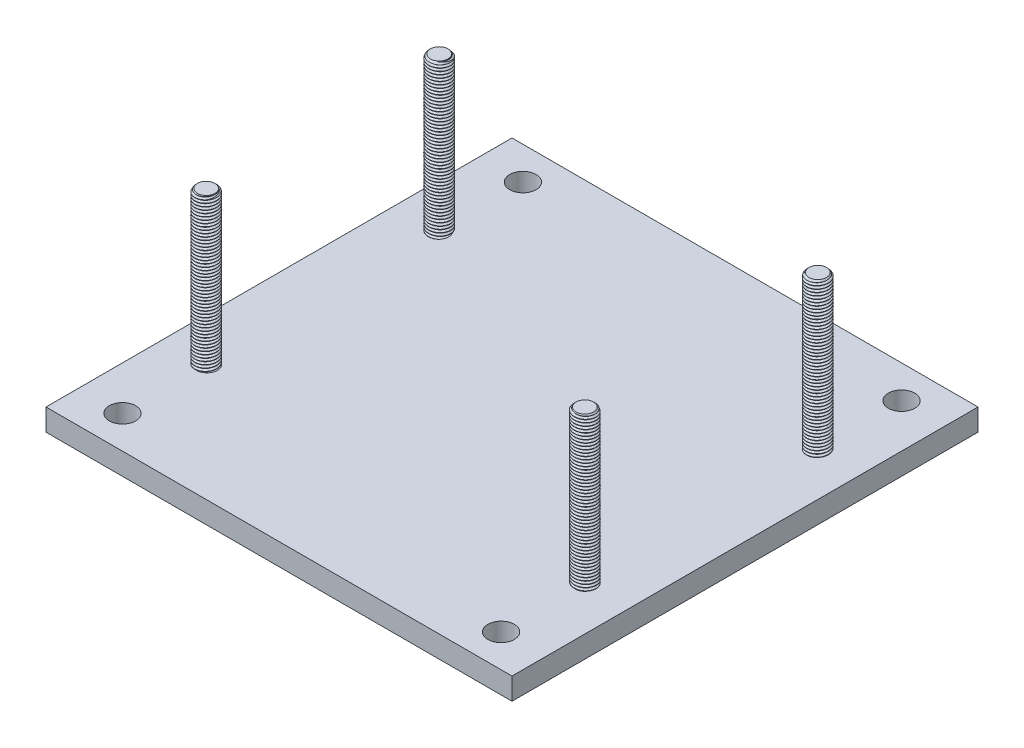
SolidWorks part; units mm, degrees
other "<95412A859_18-8 Stainless Steel Threaded Rod>-<Cut-Sweep1>"
ref_plane "Front Plane" through (0, 0, 0) normal (0, 0, 1) x (1, 0, 0)
ref_plane "Top Plane" through (0, 0, 0) normal (0, 1, 0) x (1, 0, 0)
ref_plane "Right Plane" through (0, 0, 0) normal (1, 0, 0) x (0, 0, -1)
sketch "Sketch1" plane through (0, 0, 0) normal (0, 1, 0) x (1, 0, 0)
  line L1 (-203.2, 203.2) -> (203.2, 203.2)
  line L2 (-203.2, 203.2) -> (-203.2, -203.2)
  line L3 (-203.2, -203.2) -> (203.2, -203.2)
  line L4 (203.2, 203.2) -> (203.2, -203.2)
  line L5 (-203.2, 203.2) -> (203.2, -203.2) construction
  line L6 (-203.2, -203.2) -> (203.2, 203.2) construction
  point P0 (0, 0)
  dimension "D1" = 406.4
extrude "Boss-Extrude1" add sketch "Sketch1" along normal blind 19.05
hole_wizard "3/4-10 Tapped Hole1" positions "Sketch2" profile "Sketch3" tap size "3/4-10" standard "ANSI Inch"
sketch "Sketch2" plane through (0, 19.05, 0) normal (0, 1, 0) x (1, 0, 0)
  point P0 (-165.1, -101.6)
  point P3 (165.1, -101.6)
  point P6 (-165.1, 101.6)
  point P9 (165.1, 101.6)
sketch "Sketch3" plane through (-165.1, 19.05, 101.6) normal (1, 0, 0) x (0, 0, 1)
  line L0 (0, 0) -> (0, 19.05)
  line L1 (0, 19.05) -> (8.3337, 19.05)
  line L2 (8.3337, 19.05) -> (8.3337, 0)
  line L5 (8.3337, 0) -> (0, 0)
  line L11 (0, -6.35) -> (0, 107.95) construction
  dimension "Thread Major Dia." = 16.6675
  dimension "Thru Tap Drill Depth" = 19.05
hole_wizard "7/8 Clearance Hole1" positions "Sketch4" profile "Sketch5" hole size "7/8" standard "ANSI Inch"
sketch "Sketch4" plane through (0, 19.05, 0) normal (0, 1, 0) x (1, 0, 0)
  line L0 (-203.2, 0) -> (-95.2664, 0) construction
  line L1 (-203.2, 203.2) -> (-203.2, -203.2) construction
  line L4 (-165.1, -101.6) -> (-165.1, -174.625) construction
  line L6 (-203.2, -203.2) -> (203.2, -203.2) construction
  line L7 (0, -203.2) -> (0, -96.8124) construction
  point P0 (-165.1, -174.625)
  point P2 (-165.1, 174.625)
  point P25 (165.1, -174.625)
  point P26 (165.1, 174.625)
  dimension "D1" = 28.575
sketch "Sketch5" plane through (-165.1, 19.05, 174.625) normal (1, 0, 0) x (0, 0, 1)
  line L0 (0, 0) -> (0, 19.05)
  line L1 (0, 19.05) -> (11.5087, 19.05)
  line L2 (11.5087, 19.05) -> (11.5087, 0)
  line L5 (11.5087, 0) -> (0, 0)
  line L11 (0, -6.35) -> (0, 107.95) construction
  dimension "Thru Hole Dia." = 23.0175
  dimension "Thru Hole Depth" = 19.05
inserted part "95412A859_18-8 Stainless Steel Threaded Rod"
move or copy body "Body-Move/Copy8" placed by mates yes
mirror "Mirror3" about plane through (0, 0, 0) normal (0, 0, 1)
mirror "Mirror4" about plane through (0, 0, 0) normal (1, 0, 0)
